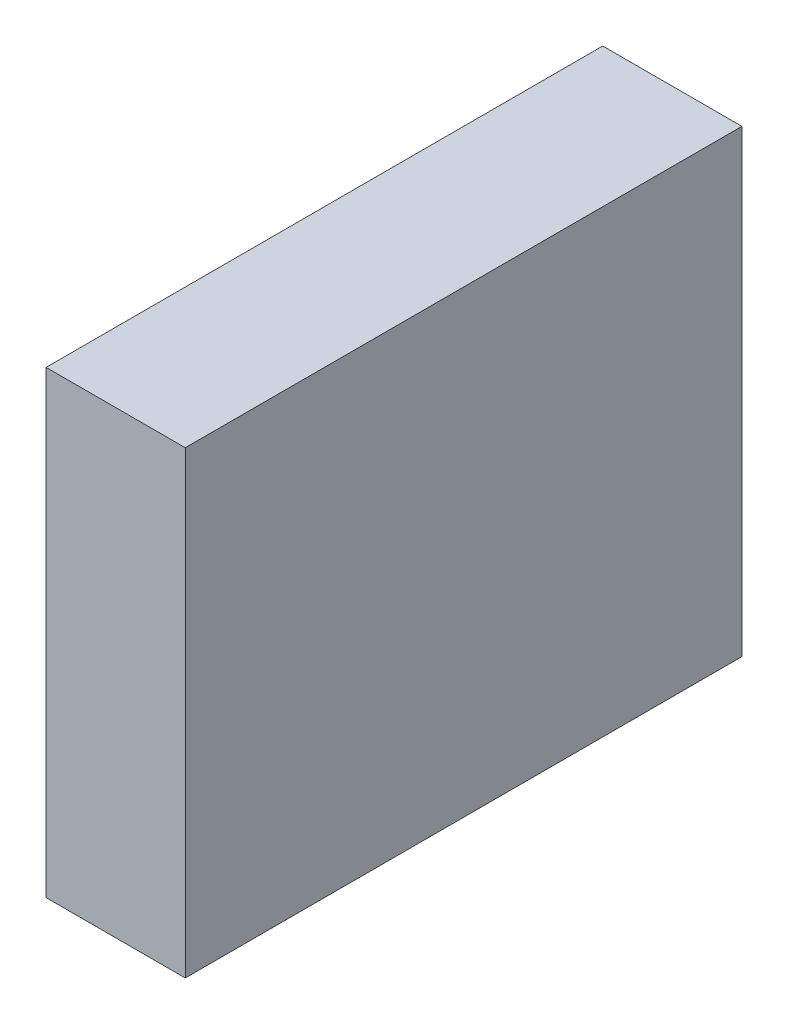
SolidWorks part; units mm, degrees
ref_plane "Front Plane" through (0, 0, 0) normal (0, 0, 1) x (1, 0, 0)
ref_plane "Top Plane" through (0, 0, 0) normal (0, 1, 0) x (1, 0, 0)
ref_plane "Right Plane" through (0, 0, 0) normal (1, 0, 0) x (0, 0, -1)
sketch "Sketch1" plane through (0, 0, 0) normal (0, 1, 0) x (1, 0, 0)
  line L1 (0, 0) -> (2.54, 0)
  line L2 (0, 0) -> (0, 10.16)
  line L3 (0, 10.16) -> (2.54, 10.16)
  line L4 (2.54, 0) -> (2.54, 10.16)
  dimension "D1" = 2.54
  dimension "D2" = 10.16
extrude "Boss-Extrude1" add sketch "Sketch1" along normal blind 8.382
